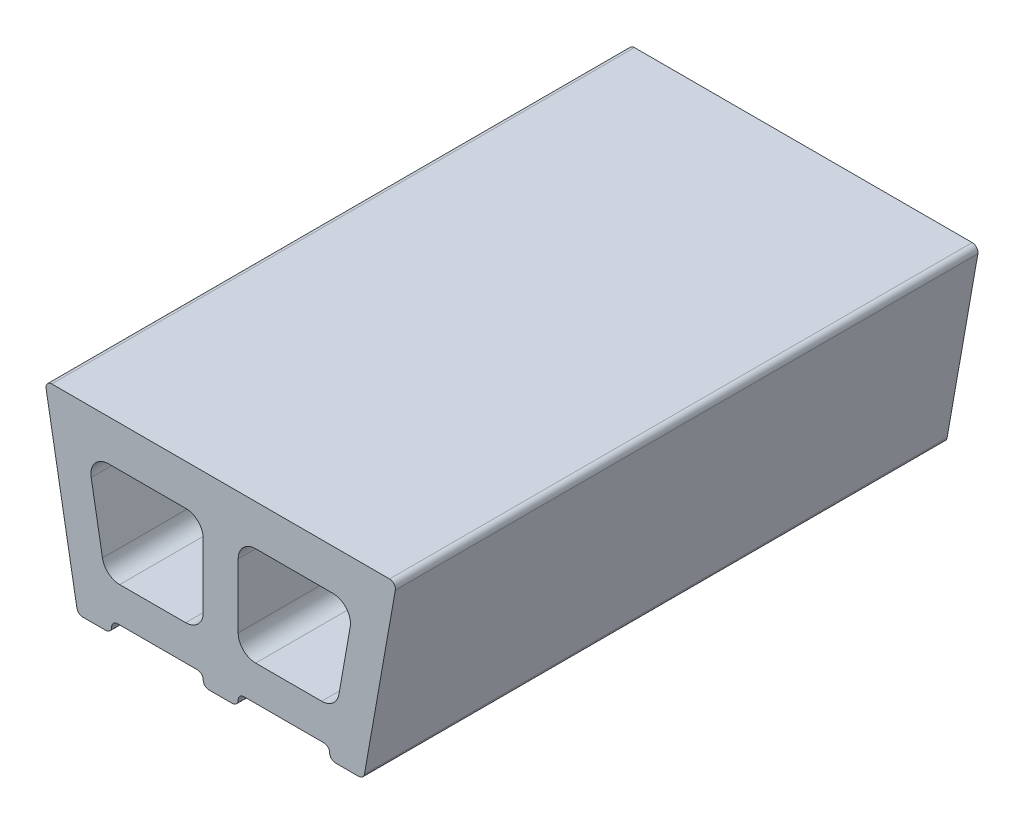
SolidWorks part; units mm, degrees
ref_plane "Plan de face" through (0, 0, 0) normal (0, 0, 1) x (1, 0, 0)
ref_plane "Plan de dessus" through (0, 0, 0) normal (0, 1, 0) x (1, 0, 0)
ref_plane "Plan de droite" through (0, 0, 0) normal (1, 0, 0) x (0, 0, -1)
sketch "Esquisse1" plane through (0, 0, 0) normal (0, 0, 1) x (1, 0, 0)
  line L0 (0, 0) -> (0, 141.015) construction
  line L1 (-150, 150) -> (150, 150)
  line L2 (150, 150) -> (123.551, 0)
  line L3 (123.551, 0) -> (-123.551, 0)
  line L4 (-123.551, 0) -> (-150, 150)
  dimension "D1" = 300
  dimension "D2" = 150
  dimension "D3" = 100
extrude "Boss.-Extru.1" add sketch "Esquisse1" along normal blind 500
sketch "Esquisse2" plane through (0, 0, 500) normal (0, 0, 1) x (1, 0, 0)
  line L0 (-150, 150) -> (-123.551, 0) construction
  line L1 (-114.2474, 120) -> (-15, 120)
  line L2 (-114.2474, 120) -> (-99.2596, 35)
  line L3 (-99.2596, 35) -> (-15, 35)
  line L4 (-15, 120) -> (-15, 35)
  line L5 (150, 150) -> (-150, 150) construction
  line L6 (-123.551, 0) -> (123.551, 0) construction
  dimension "D1" = 30
  dimension "D2" = 30
  dimension "D3" = 35
  dimension "D4" = 15
extrude "Enlèv. mat.-Extru.1" cut sketch "Esquisse2" against normal through all
mirror "Symétrie1" about plane through (0, 0, 0) normal (1, 0, 0) of "Enlèv. mat.-Extru.1"
fillet "Congé1" radius 15 8 edges at (15, 35, 250) (99.2596, 35, 250) (114.2474, 120, 250) (15, 120, 250) (-99.2596, 35, 250) (-15, 35, 250) (-15, 120, 250) (-114.2474, 120, 250)
sketch "Esquisse3" plane through (0, 0, 500) normal (0, 0, 1) x (1, 0, 0)
  line L0 (-123.551, 0) -> (123.551, 0) construction
  line L1 (-93.551, 0) -> (-15, 0)
  line L2 (-93.551, 0) -> (-93.551, 5)
  line L3 (-93.551, 5) -> (-15, 5)
  line L4 (-15, 0) -> (-15, 5)
  line L5 (0, 0) -> (0, 169.009) construction
  line L6 (15, 0) -> (93.551, 0)
  line L7 (15, 0) -> (15, 5)
  line L8 (15, 5) -> (93.551, 5)
  line L9 (93.551, 0) -> (93.551, 5)
  dimension "D1" = 30
  dimension "D2" = 30
  dimension "D3" = 30
  dimension "D4" = 5
extrude "Enlèv. mat.-Extru.2" cut sketch "Esquisse3" against normal through all
fillet "Congé2" radius 5 4 edges at (93.551, 5, 250) (15, 5, 250) (-15, 5, 250) (-93.551, 5, 250)
sketch "Esquisse4" plane through (0, 0, 500) normal (0, 0, 1) x (1, 0, 0)
  line L0 (-150, 150) -> (-150.8816, 155)
  line L1 (-150.8816, 155) -> (150.8816, 155)
  line L2 (150.8816, 155) -> (150, 150)
  line L3 (150, 150) -> (-150, 150)
  line L4 (-150, 150) -> (-123.551, 0) construction
  line L5 (123.551, 0) -> (150, 150) construction
  dimension "D1" = 5
extrude "Boss.-Extru.2" add sketch "Esquisse4" against normal blind 500
fillet "Congé3" radius 5 2 edges at (150.8816, 155, 250) (-150.8816, 155, 250)
sketch "Esquisse5" plane through (0, 0, 500) normal (0, 0, 1) x (1, 0, 0)
  line L0 (-123.551, 0) -> (-122.6693, -5)
  line L1 (-122.6693, -5) -> (-93.551, -5)
  line L2 (-93.551, -5) -> (-93.551, 0)
  line L3 (-123.551, 0) -> (-93.551, 0) construction
  line L4 (-149.8469, 149.1318) -> (-123.551, 0) construction
  line L5 (-15, 0) -> (15, 0)
  line L6 (-15, 0) -> (-15, -5)
  line L7 (-15, -5) -> (15, -5)
  line L8 (15, 0) -> (15, -5)
  line L9 (93.551, 0) -> (123.551, 0)
  line L10 (93.551, 0) -> (93.551, -5)
  line L11 (93.551, -5) -> (122.6693, -5)
  line L12 (123.551, 0) -> (122.6693, -5)
  line L13 (123.551, 0) -> (149.8469, 149.1318) construction
  line L14 (-123.551, 0) -> (-93.551, 0)
  point P23 (-108.551, 0)
  dimension "D1" = 5
extrude "Boss.-Extru.3" add sketch "Esquisse5" against normal blind 500
fillet "Congé4" radius 5 2 edges at (-93.551, -5, 250) (-122.6693, -5, 250)
fillet "Congé5" radius 5 2 edges at (15, -5, 250) (-15, -5, 250)
fillet "Congé6" radius 5 2 edges at (122.6693, -5, 250) (93.551, -5, 250)
